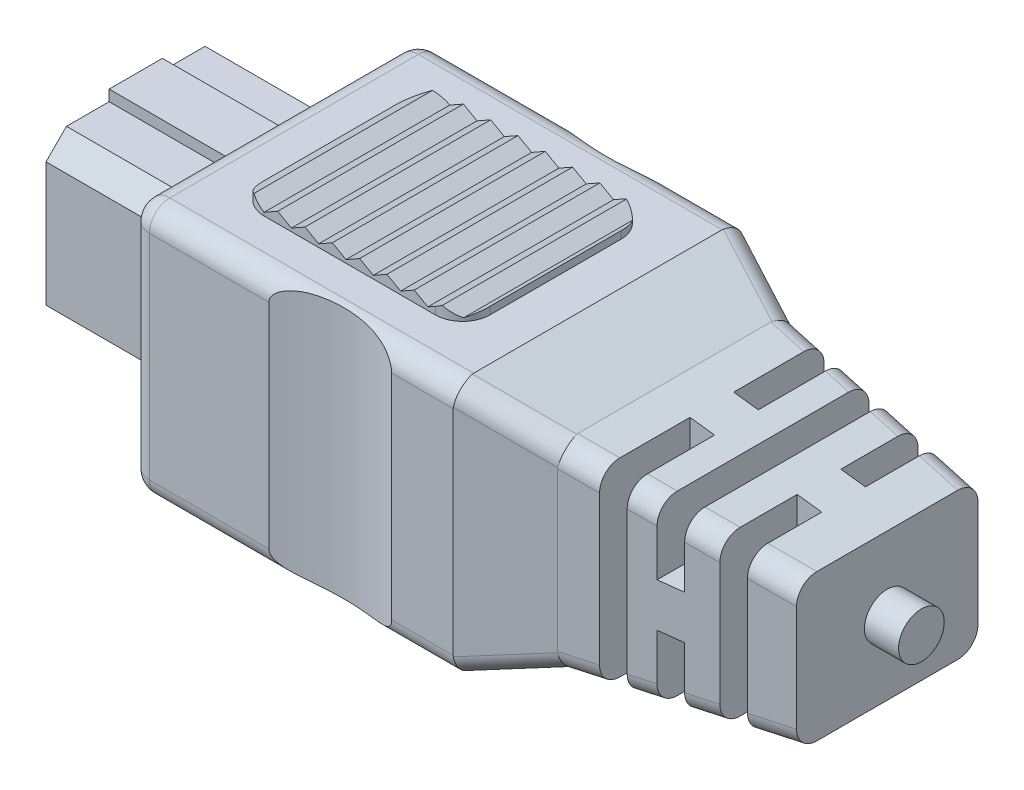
SolidWorks part; units mm, degrees
ref_plane "Front" through (0, 0, 0) normal (0, 0, 1) x (1, 0, 0)
ref_plane "Top" through (0, 0, 0) normal (0, 1, 0) x (1, 0, 0)
ref_plane "Right" through (0, 0, 0) normal (1, 0, 0) x (0, 0, -1)
sketch "Sketch1" plane through (0, 0, 0) normal (1, 0, 0) x (0, 0, -1)
  line L0 (0, 9.4742) -> (0, 0) construction
  line L1 (-5.3848, 9.4742) -> (5.3848, 9.4742)
  line L2 (-5.3848, 9.4742) -> (-5.3848, 0)
  line L3 (-5.3848, 0) -> (5.3848, 0)
  line L4 (5.3848, 9.4742) -> (5.3848, 0)
  dimension "D1" = 9.4742
  dimension "D2" = 10.7696
extrude "Extrude1" add sketch "Sketch1" along normal blind 12.065
sketch "Sketch3" plane through (12.065, 0, 0) normal (1, 0, 0) x (0, 0, -1)
  line L1 (-5.3848, 9.4742) -> (5.3848, 9.4742)
  line L2 (-5.3848, 9.4742) -> (-5.3848, 0)
  line L3 (-5.3848, 0) -> (5.3848, 0)
  line L4 (5.3848, 9.4742) -> (5.3848, 0)
extrude "Extrude2" add sketch "Sketch3" along normal blind 2.8448 draft 20
sketch "Sketch4" plane through (14.9098, 0, 0) normal (1, 0, 0) x (0, 0, -1)
  line L1 (-4.3494, 8.4388) -> (4.3494, 8.4388)
  line L2 (-4.3494, 8.4388) -> (-4.3494, 1.0354)
  line L3 (-4.3494, 1.0354) -> (4.3494, 1.0354)
  line L4 (4.3494, 8.4388) -> (4.3494, 1.0354)
extrude "Extrude3" add sketch "Sketch4" along normal blind 7.9248 draft 7
sketch "Sketch5" plane through (0, 0, 0) normal (0, 1, 0) x (1, 0, 0)
  line L0 (22.8346, 0) -> (14.9098, 0) construction
  line L1 (22.8346, 3.3763) -> (22.8346, -3.3763) construction
  line L2 (14.9098, 4.3494) -> (14.9098, -4.3494) construction
  line L3 (20.2946, 0.8128) -> (17.2212, 0.8128) construction
  line L4 (20.2946, 6.8287) -> (21.209, 6.8287)
  line L5 (20.2946, 6.8287) -> (20.2946, 0.8128)
  line L6 (20.2946, 0.8128) -> (21.209, 0.8128)
  line L7 (21.209, 6.8287) -> (21.209, 0.8128)
  line L8 (16.3068, 0.8128) -> (17.2212, 0.8128)
  line L9 (16.3068, 0.8128) -> (16.3068, 7.1993)
  line L10 (16.3068, 7.1993) -> (17.2212, 7.1993)
  line L11 (17.2212, 0.8128) -> (17.2212, 7.1993)
  dimension "D1" = 0.9144
  dimension "D2" = 1.6256
  dimension "D3" = 0.8128
  dimension "D4" = 0.9144
  dimension "D5" = 3.0734
extrude "Cut-Extrude1" cut sketch "Sketch5" along normal through all
mirror "Mirror1" about plane through (0, 0, 0) normal (0, 0, 1) of "Cut-Extrude1"
sketch "Sketch6" plane through (0, 0, 0) normal (0, 0, 1) x (1, 0, 0)
  line L0 (22.8346, 4.7371) -> (12.065, 4.7371) construction
  line L1 (22.8346, 7.4657) -> (22.8346, 2.0085) construction
  line L2 (12.065, 9.4742) -> (12.065, 0) construction
  line L3 (20.2946, 7.7776) -> (20.2946, 1.6966) construction
  line L4 (18.2118, 8.7339) -> (19.1262, 8.7339)
  line L5 (18.2118, 8.7339) -> (18.2118, 5.5499)
  line L6 (18.2118, 5.5499) -> (19.1262, 5.5499)
  line L7 (19.1262, 8.7339) -> (19.1262, 5.5499)
  line L8 (18.2118, 3.9243) -> (19.1262, 3.9243)
  line L9 (19.1262, 0.7403) -> (19.1262, 3.9243)
  line L10 (18.2118, 0.7403) -> (19.1262, 0.7403)
  line L11 (18.2118, 0.7403) -> (18.2118, 3.9243)
  dimension "D1" = 0.9144
  dimension "D2" = 1.1684
  dimension "D3" = 0.8128
extrude "Cut-Extrude2" cut sketch "Sketch6" along normal through all and the other way through all
sketch "Sketch7" plane through (0, 0, 0.8128) normal (0, 0, 1) x (1, 0, 0)
  line L0 (22.8346, 4.7371) -> (14.9098, 4.7371) construction
  line L1 (22.8346, 7.4657) -> (22.8346, 2.0085) construction
  line L2 (14.9098, 8.4388) -> (14.9098, 1.0354) construction
  line L3 (16.3068, 3.937) -> (16.3068, 5.5372)
  line L4 (16.3068, 8.2672) -> (16.3068, 1.207) construction
  line L5 (16.3068, 1.207) -> (16.3068, 8.2672) construction
  line L6 (16.3068, 5.5372) -> (17.2212, 5.5372)
  line L7 (17.2212, 8.155) -> (17.2212, 1.3192) construction
  line L8 (17.2212, 5.5372) -> (17.2212, 3.937)
  line L9 (20.2946, 3.937) -> (20.2946, 5.5372)
  line L10 (20.2946, 1.6966) -> (20.2946, 7.7776) construction
  line L11 (20.2946, 5.5372) -> (21.209, 5.5372)
  line L12 (21.209, 7.6653) -> (21.209, 1.8089) construction
  line L13 (21.209, 5.5372) -> (21.209, 3.937)
  line L14 (20.2946, 3.937) -> (21.209, 3.937)
  line L15 (16.3068, 3.937) -> (17.2212, 3.937)
  point P25 (21.209, 4.7371)
  point P26 (20.2946, 4.7371)
  point P27 (17.2212, 4.7371)
  point P28 (16.3068, 4.7371)
  dimension "D1" = 1.6002
  dimension "D2" = 1.6002
extrude "Extrude4" add sketch "Sketch7" along normal blind 1.524
mirror "Mirror2" about plane through (0, 0, 0) normal (0, 0, 1) of "Extrude4"
sketch "Sketch8" plane through (0, 0, 0) normal (-1, 0, 0) x (0, 0, 1)
  line L0 (0, 7.8105) -> (0, 1.6637) construction
  line L1 (-3.3401, 7.8105) -> (3.3401, 7.8105)
  line L2 (-3.3401, 7.8105) -> (-3.3401, 1.6637)
  line L3 (-3.3401, 1.6637) -> (3.3401, 1.6637)
  line L4 (3.3401, 7.8105) -> (3.3401, 1.6637)
  line L6 (5.3848, 4.7371) -> (-5.3848, 4.7371) construction
  line L7 (5.3848, 9.4742) -> (5.3848, 0) construction
  line L8 (-5.3848, 0) -> (-5.3848, 9.4742) construction
  line L9 (-2.8829, 7.1501) -> (2.8829, 7.1501)
  line L10 (-2.8829, 7.1501) -> (-2.8829, 2.1209)
  line L11 (-2.8829, 2.1209) -> (2.8829, 2.1209)
  line L12 (2.8829, 7.1501) -> (2.8829, 2.1209)
  point P14 (0, 4.7371)
  point P15 (0, 4.7371)
  dimension "D1" = 6.1468
  dimension "D2" = 6.6802
  dimension "D3" = 0.6604
  dimension "D4" = 0.4572
  dimension "D5" = 0.4572
  dimension "D6" = 0.4572
extrude "Extrude5" add sketch "Sketch8" along normal blind 5.1308
sketch "Sketch9" plane through (0, 7.8105, 0) normal (0, 1, 0) x (-1, 0, 0)
  line L0 (0, 0.9906) -> (0, -0.9906)
  line L1 (0, -5.3848) -> (0, 5.3848) construction
  line L2 (0, -0.9906) -> (5.1308, -0.9906)
  line L3 (5.1308, 3.3401) -> (5.1308, -3.3401) construction
  line L4 (5.1308, -0.9906) -> (5.1308, 0.9906)
  line L5 (5.1308, 0) -> (0, 0) construction
  line L6 (0, 0.9906) -> (5.1308, 0.9906)
  dimension "D1" = 1.9812
extrude "Extrude6" add sketch "Sketch9" along normal blind 0.4064
sketch "Sketch11" plane through (22.8346, 0, 0) normal (1, 0, 0) x (0, 0, -1)
  line L0 (-3.3763, 4.7371) -> (3.3763, 4.7371) construction
  line L1 (-3.3763, 7.4657) -> (-3.3763, 2.0085) construction
  line L2 (3.3763, 2.0085) -> (3.3763, 7.4657) construction
  circle A0 centre (0, 4.7371) radius 0.8509
  dimension "D1" = 1.7018
extrude "Extrude7" add sketch "Sketch11" along normal blind 1.27
chamfer "Chamfer1" distance 0.762 angle 45 4 edges at (-2.5654, 1.6637, -3.3401) (-2.5654, 1.6637, 3.3401) (-2.5654, 7.8105, -3.3401) (-2.5654, 7.8105, 3.3401)
fillet "Fillet1" radius 0.762 28 edges at (15.6083, 8.353, -4.2636) (17.7165, 8.0942, -4.0048) (19.7104, 7.8493, -3.7599) (22.0218, 7.5655, -3.4761) (22.0218, 1.9087, -3.4761) (19.7104, 1.6249, -3.7599) (17.7165, 1.38, -4.0048) (15.6083, 1.1212, -4.2636) (22.0218, 7.5655, 3.4761) (19.7104, 7.8493, 3.7599) (17.7165, 8.0942, 4.0048) (15.6083, 8.353, 4.2636) (22.0218, 1.9087, 3.4761) (19.7104, 1.6249, 3.7599) (17.7165, 1.38, 4.0048) (15.6083, 1.1212, 4.2636) (13.4874, 0.5177, -4.8671) (13.4874, 0.5177, 4.8671) (13.4874, 8.9565, -4.8671) (13.4874, 8.9565, 4.8671) (6.0325, 0, -5.3848) (6.0325, 0, 5.3848) (6.0325, 9.4742, -5.3848) (6.0325, 9.4742, 5.3848) (0, 4.7371, -5.3848) (0, 0, 0) (0, 4.7371, 5.3848) (0, 9.4742, 0)
fillet "Fillet2" radius 0.762 8 edges at (20.7518, 3.937, -2.3368) (20.7518, 5.5372, -2.3368) (16.764, 5.5372, -2.3368) (16.764, 3.937, -2.3368) (20.7518, 5.5372, 2.3368) (20.7518, 3.937, 2.3368) (16.764, 5.5372, 2.3368) (16.764, 3.937, 2.3368)
sketch "Sketch12" plane through (0, 0, 0) normal (0, 1, 0) x (1, 0, 0)
  line L1 (0.762, 5.3848) -> (12.065, 5.3848) construction
  line L2 (9.779, 5.3848) -> (5.207, 5.3848)
  arc A0 (5.207, 5.3848) -> (9.779, 5.3848) centre (7.493, 10.2883) ccw
  dimension "D3" = 5.4102
  dimension "D1" = 4.445
  dimension "D2" = 4.572
extrude "Cut-Extrude3" cut sketch "Sketch12" against normal blind 2.54 and the other way through all
mirror "Mirror3" about plane through (0, 0, 0) normal (0, 0, 1) of "Cut-Extrude3"
sketch "Sketch13" plane through (0, 9.4742, 0) normal (0, 1, 0) x (-1, 0, 0)
  line L0 (-2.0828, 0) -> (-10.4902, 0) construction
  line L1 (-10.4902, -3.4544) -> (-2.0828, -3.4544)
  line L2 (-10.4902, -3.4544) -> (-10.4902, 3.4544)
  line L3 (-10.4902, 3.4544) -> (-2.0828, 3.4544)
  line L4 (-2.0828, -3.4544) -> (-2.0828, 3.4544)
  line L5 (-0.762, -4.6228) -> (-0.762, 4.6228) construction
  dimension "D1" = 8.4074
  dimension "D2" = 6.9088
  dimension "D3" = 1.3208
extrude "top grip" add sketch "Sketch13" along normal blind 0.4064
fillet "grip fillets" radius 1.016 4 edges at (2.0828, 9.6774, 3.4544) (10.4902, 9.6774, -3.4544) (10.4902, 9.6774, 3.4544) (2.0828, 9.6774, -3.4544)
sketch "Sketch14" plane through (0, 0, 3.4544) normal (0, 0, 1) x (1, 0, 0)
  line L0 (2.0828, 9.5937) -> (2.5908, 9.8806)
  line L1 (2.0828, 9.4742) -> (2.0828, 9.8806) construction
  line L2 (3.0988, 9.8806) -> (2.0828, 9.8806) construction
  line L3 (2.5908, 9.8806) -> (3.0988, 9.5937)
  line L4 (3.0988, 9.8806) -> (3.0988, 9.4742) construction
  line L5 (2.0828, 9.5937) -> (2.0828, 9.8806)
  line L6 (2.0828, 9.8806) -> (2.5908, 10.0979)
  line L7 (3.0988, 9.8806) -> (3.0988, 9.5937)
  line L8 (2.5908, 10.0979) -> (3.0988, 9.8806)
extrude "grip grooves" cut sketch "Sketch14" against normal through all and the other way through all
pattern_linear "LPattern1" count 9 spacing 1.016 along (1, 0, 0) of "grip grooves"
sketch "Sketch16" plane through (24.1046, 0, 0) normal (1, 0, 0) x (0, 0, -1)
  point P0 (0, 4.7371)
ref_plane "Plane1" through (0, 4.7371, 0) normal (0, 1, 0) x (-1, 0, 0)
mirror "bottom grip" about plane through (0, 4.7371, 0) normal (0, 1, 0) of "grip fillets", "top grip", "LPattern1", "grip grooves"
